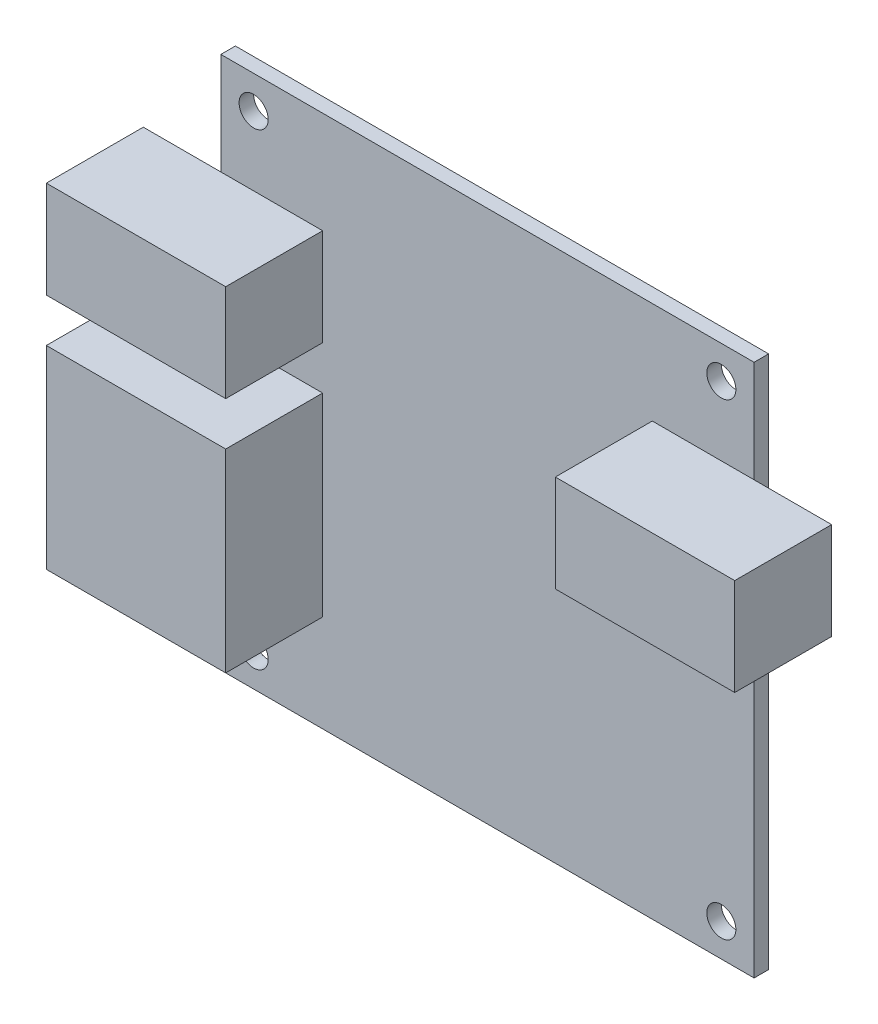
SolidWorks part; units mm, degrees
ref_plane "Plan de face" through (0, 0, 0) normal (0, 0, 1) x (1, 0, 0)
ref_plane "Plan de dessus" through (0, 0, 0) normal (0, 1, 0) x (1, 0, 0)
ref_plane "Plan de droite" through (0, 0, 0) normal (1, 0, 0) x (0, 0, -1)
sketch "Esquisse1" plane through (0, 0, 0) normal (0, 0, 1) x (1, 0, 0)
  line L1 (27.5, -27.5) -> (-27.5, -27.5)
  line L2 (27.5, -27.5) -> (27.5, 27.5)
  line L3 (27.5, 27.5) -> (-27.5, 27.5)
  line L4 (-27.5, -27.5) -> (-27.5, 27.5)
  line L5 (27.5, -27.5) -> (-27.5, 27.5) construction
  line L6 (27.5, 27.5) -> (-27.5, -27.5) construction
  point P0 (0, 0)
  dimension "D1" = 55
  dimension "D2" = 55
extrude "Boss.-Extru.1" add sketch "Esquisse1" along normal blind 1.5
sketch "Esquisse2" plane through (0, 0, 1.5) normal (0, 0, 1) x (1, 0, 0)
  line L0 (-27.5, 27.5) -> (-27.5, -27.5) construction
  line L1 (27.5, -27.5) -> (27.5, 27.5) construction
  line L2 (27.5, 27.5) -> (-27.5, 27.5) construction
  line L3 (-27.5, -27.5) -> (27.5, -27.5) construction
  circle A0 centre (-24.12, 24.12) radius 1.5
  circle A1 centre (-24.12, -24.12) radius 1.5
  circle A2 centre (24.12, -24.12) radius 1.5
  circle A3 centre (24.12, 24.12) radius 1.5
  dimension "D3" = 3.38
  dimension "D4" = 3.38
  dimension "D7" = 3.38
  dimension "D8" = 3.38
  dimension "D9" = 3
  dimension "D10" = 3
  dimension "D11" = 3
  dimension "D12" = 3
  dimension "D1" = 3.38
  dimension "D2" = 3.38
  dimension "D5" = 3.38
  dimension "D6" = 3.38
extrude "Enlèv. mat.-Extru.1" cut sketch "Esquisse2" against normal through all
sketch "Esquisse3" plane through (0, 0, 1.5) normal (0, 0, 1) x (1, 0, 0)
  line L0 (-27.5, 27.5) -> (-27.5, -27.5) construction
  line L1 (-17, 17) -> (-35.5, 17)
  line L2 (-17, 17) -> (-17, 7)
  line L3 (-17, 7) -> (-35.5, 7)
  line L4 (-35.5, 17) -> (-35.5, 7)
  line L5 (-17, 2.5) -> (-35.5, 2.5)
  line L6 (-17, 2.5) -> (-17, -17.5)
  line L7 (-17, -17.5) -> (-35.5, -17.5)
  line L8 (-35.5, 2.5) -> (-35.5, -17.5)
  line L9 (17, 17) -> (35.5, 17)
  line L10 (17, 17) -> (17, 7)
  line L11 (17, 7) -> (35.5, 7)
  line L12 (35.5, 17) -> (35.5, 7)
  line L13 (27.5, -27.5) -> (27.5, 27.5) construction
  line L14 (27.5, 27.5) -> (-27.5, 27.5) construction
  line L15 (-27.5, -27.5) -> (27.5, -27.5) construction
  dimension "D1" = 10
  dimension "D2" = 18.5
  dimension "D3" = 18.5
  dimension "D4" = 18.5
  dimension "D5" = 8
  dimension "D6" = 8
  dimension "D7" = 8
  dimension "D8" = 10.5
  dimension "D9" = 10
  dimension "D10" = 10.5
  dimension "D11" = 10
  dimension "D12" = 20
extrude "Boss.-Extru.2" add sketch "Esquisse3" along normal blind 10
sketch "Esquisse4"
